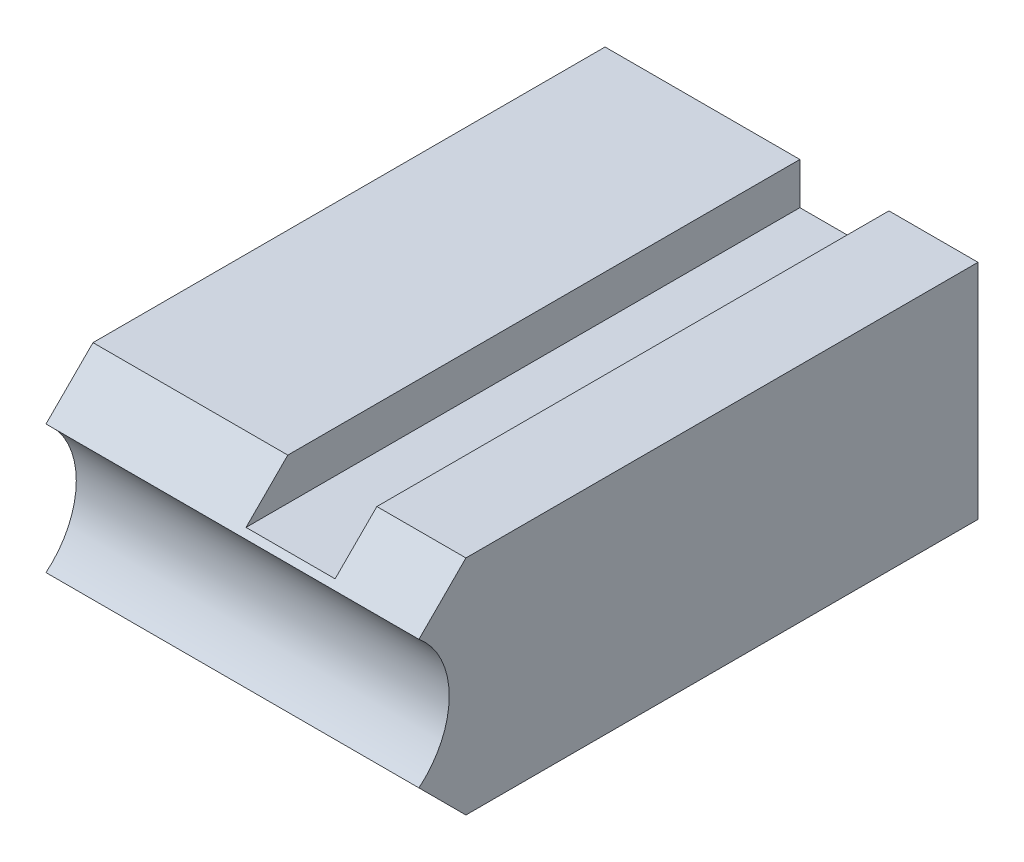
SolidWorks part; units mm, degrees
ref_plane "Face" through (0, 0, 0) normal (0, 0, 1) x (1, 0, 0)
ref_plane "Dessus" through (0, 0, 0) normal (0, 1, 0) x (1, 0, 0)
ref_plane "Droite" through (0, 0, 0) normal (1, 0, 0) x (0, 0, -1)
sketch "Esquisse1" plane through (0, 0, 0) normal (0, 0, 1) x (1, 0, 0)
  line L0 (118, 12.5) -> (134, 12.5) construction
  line L1 (118, -12.5) -> (118, 12.5) construction
  line L2 (118, -12.5) -> (134, -12.5) construction
  line L3 (134, -12.5) -> (134, -25) construction
  line L5 (150, 25) -> (150, -25) construction
  line L7 (134, 12.5) -> (134, 25) construction
  line L8 (118, 12.5) -> (134, 12.5)
  line L9 (118, -12.5) -> (118, 12.5)
  line L10 (118, -12.5) -> (134, -12.5)
  line L11 (134, -12.5) -> (134, -20)
  line L13 (150, 20) -> (150, -20)
  line L14 (134, 89.1428) -> (134, 1.8614) construction
  line L15 (134, 12.5) -> (134, 20)
  line L16 (118, 0) -> (170.3347, 0) construction
  line L17 (150, 89.1428) -> (150, 1.8614) construction
  line L18 (134, 20) -> (150, 20)
  line L19 (134, -89.1428) -> (134, -1.8614) construction
  line L20 (150, -89.1428) -> (150, -1.8614) construction
  line L21 (134, -20) -> (150, -20)
  dimension "D1" = 40
extrude "Boss.-Extru.1" add sketch "Esquisse1" against normal blind 110
sketch "Esquisse2" plane through (0, 0, 0) normal (0, 0, 1) x (1, 0, 0)
  line L1 (118, 20) -> (83, 20)
  line L2 (118, 20) -> (118, -20)
  line L3 (118, -20) -> (83, -20)
  line L4 (83, 20) -> (83, -20)
  line L6 (118, 12.5) -> (118, -12.5) construction
  line L7 (118, 0) -> (57.6049, 0) construction
  dimension "D1" = 35
  dimension "D2" = 40
extrude "Boss.-Extru.2" add sketch "Esquisse2" against normal up to surface (110 mm away)
sketch "Esquisse3" plane through (83, 0, 0) normal (-1, 0, 0) x (0, 0, 1)
  line L0 (0, 0) -> (-62.1781, 0) construction
  line L1 (0, 20) -> (0, -20)
  line L2 (0, -20) -> (-18, -20)
  line L3 (-18, -20) -> (-9.5594, -11.5594)
  line L4 (-110, -20) -> (0, -20) construction
  line L5 (0, 20) -> (0, -20) construction
  line L6 (0, 20) -> (-18, 20)
  line L7 (-18, 20) -> (-9.5594, 11.5594)
  arc A0 (-9.5594, -11.5594) -> (-9.5594, 11.5594) centre (0, 0) cw
  dimension "D2" = 15
  dimension "D1" = 45
  dimension "D3" = 18
extrude "Enlèv. mat.-Extru.1" cut sketch "Esquisse3" against normal through all
